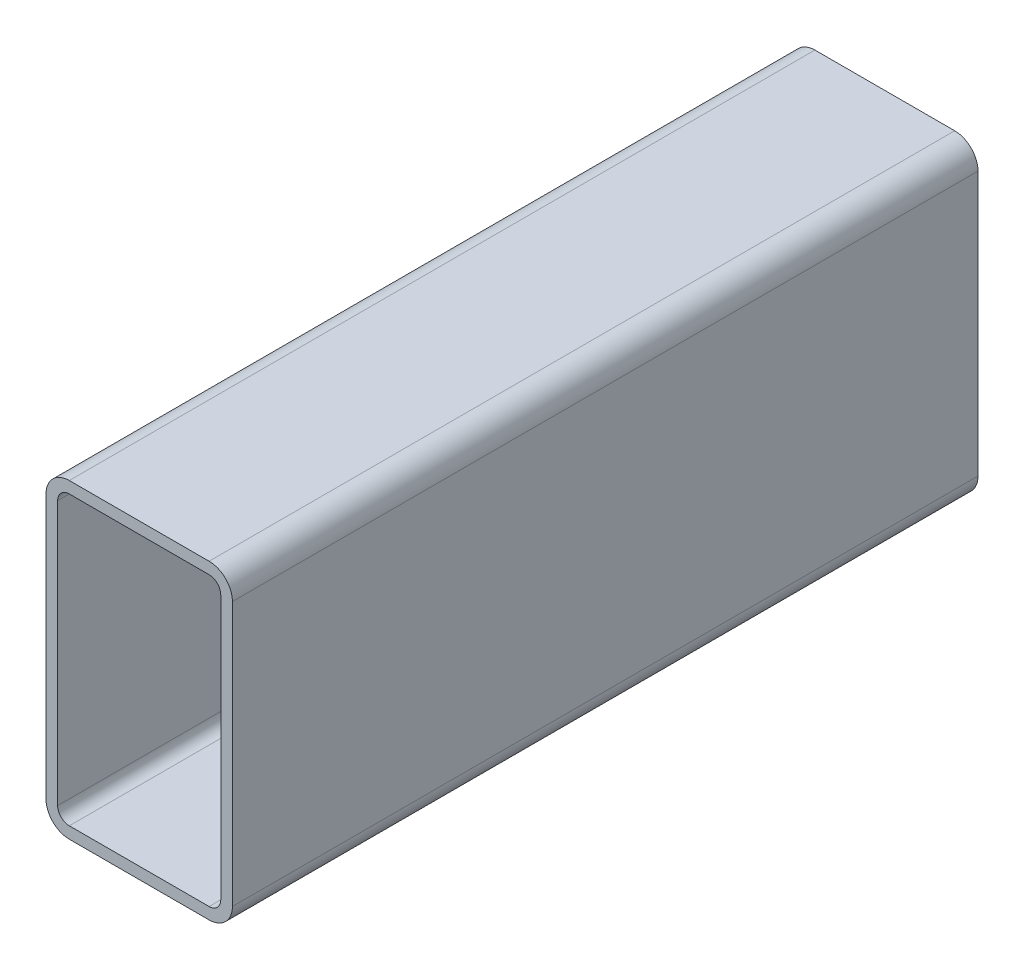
SolidWorks part; units mm, degrees
ref_plane "Front Plane" through (0, 0, 0) normal (0, 0, 1) x (1, 0, 0)
ref_plane "Top Plane" through (0, 0, 0) normal (0, 1, 0) x (1, 0, 0)
ref_plane "Right Plane" through (0, 0, 0) normal (1, 0, 0) x (0, 0, -1)
sketch "Sketch1" plane through (0, 0, 0) normal (0, 0, 1) x (1, 0, 0)
sketch_block_instance "HSS5x3x0.1875-1"
sketch_block "HSS5x3x0.1875"
extrude "Boss-Extrude1" add sketch "Sketch1" along normal blind 304.8
